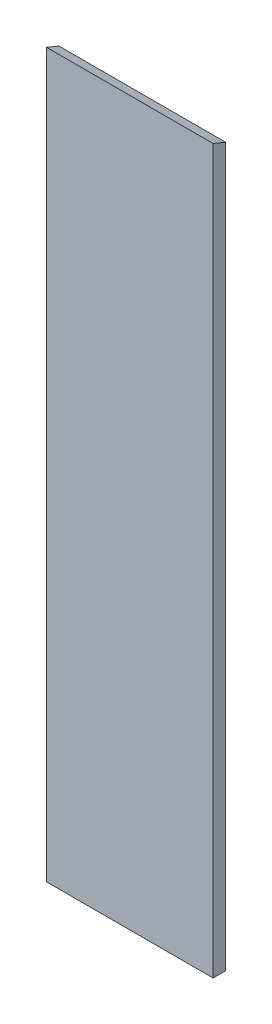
SolidWorks part; units mm, degrees
ref_plane "Plan de face" through (0, 0, 0) normal (0, 0, 1) x (1, 0, 0)
ref_plane "Plan de dessus" through (0, 0, 0) normal (0, 1, 0) x (1, 0, 0)
ref_plane "Plan de droite" through (0, 0, 0) normal (1, 0, 0) x (0, 0, -1)
sketch "Esquisse1" plane through (0, 0, 0) normal (0, 0, 1) x (1, 0, 0)
  line L1 (-100, -433.58) -> (100, -433.58)
  line L2 (-100, -433.58) -> (-100, 433.58)
  line L3 (-100, 433.58) -> (100, 433.58)
  line L4 (100, -433.58) -> (100, 433.58)
  line L5 (-100, -433.58) -> (100, 433.58) construction
  line L6 (-100, 433.58) -> (100, -433.58) construction
  point P0 (0, 0)
  dimension "D1" = 433.58
  dimension "D2" = 100
extrude "Boss.-Extru.1" add sketch "Esquisse1" along normal blind 15
sketch "Esquisse2" plane through (100, 0, 0) normal (1, 0, 0) x (0, 0, -1)
  line L0 (-15, 433.58) -> (0, 427.3668)
  line L1 (0, -433.58) -> (0, 433.58) construction
  line L2 (0, 427.3668) -> (0, 433.58)
  line L3 (0, 433.58) -> (-15, 433.58)
  dimension "D1" = 22.5
extrude "Enlèv. mat.-Extru.1" cut sketch "Esquisse2" against normal through all
